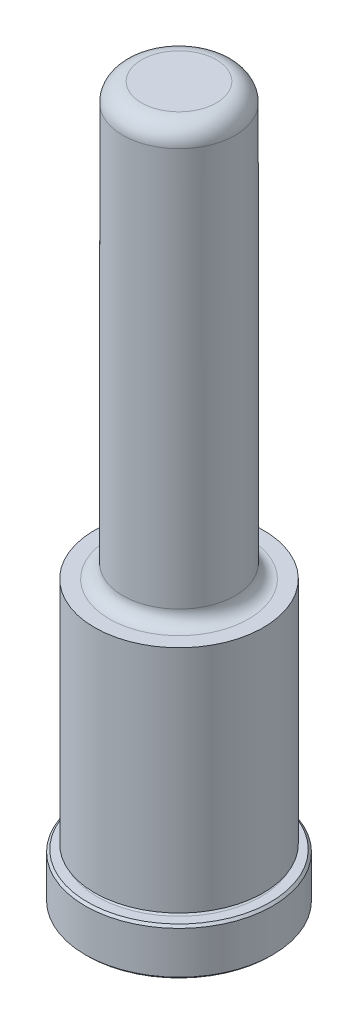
SolidWorks part; units mm, degrees
ref_plane "Front Plane" through (0, 0, 0) normal (0, 0, 1) x (1, 0, 0)
ref_plane "Top Plane" through (0, 0, 0) normal (0, 1, 0) x (1, 0, 0)
ref_plane "Right Plane" through (0, 0, 0) normal (1, 0, 0) x (0, 0, -1)
sketch "Sketch1" plane through (0, 0, 0) normal (1, 0, 0) x (0, 0, -1)
  line L0 (0, 0) -> (15.875, 0)
  line L1 (15.875, 0) -> (15.875, 7.9248)
  line L2 (15.875, 7.9248) -> (13.8938, 7.9248)
  line L3 (13.5128, 2.6782) -> (13.5128, 5.9795) construction
  line L4 (13.8938, 8.6868) -> (14.3002, 8.6868)
  line L5 (14.3002, 8.6868) -> (14.3002, 47.625)
  line L6 (14.3002, 47.625) -> (11.7983, 47.625)
  line L7 (9.5123, 49.911) -> (9.5123, 120.65)
  line L9 (9.5123, 120.65) -> (0, 120.65)
  line L10 (0, 120.65) -> (0, 0)
  line L11 (0, 0) -> (0, -7.2694) construction
  arc A0 (13.8938, 8.6868) -> (13.8938, 7.9248) centre (13.8938, 8.3058) ccw
  arc A1 (11.7983, 47.625) -> (9.5123, 49.911) centre (11.7983, 49.911) cw
  point P2 (9.5123, 120.65)
  point P14 (9.5123, 120.8325)
  point P19 (9.5123, 47.625)
  dimension "D14" = 0.762
  dimension "D8" = 2.286
  dimension "T" = 7.9248
  dimension "D2" = 0.762
  dimension "M" = 31.75
  dimension "B" = 28.6004
  dimension "L" = 120.65
  dimension "D7" = 0.7874
  dimension "A" = 47.625
  dimension "D" = 19.0246
  dimension "D15" = 73.025
revolve "Revolve1" add sketch "Sketch1" angle 360 about L11
chamfer "Chamfer1" distance 0.381 angle 45 2 edges at (0, 0, 15.875) (0, 7.9248, 15.875)
fillet "Fillet1" radius 3.175 1 edges at (0, 120.65, 9.5123)
